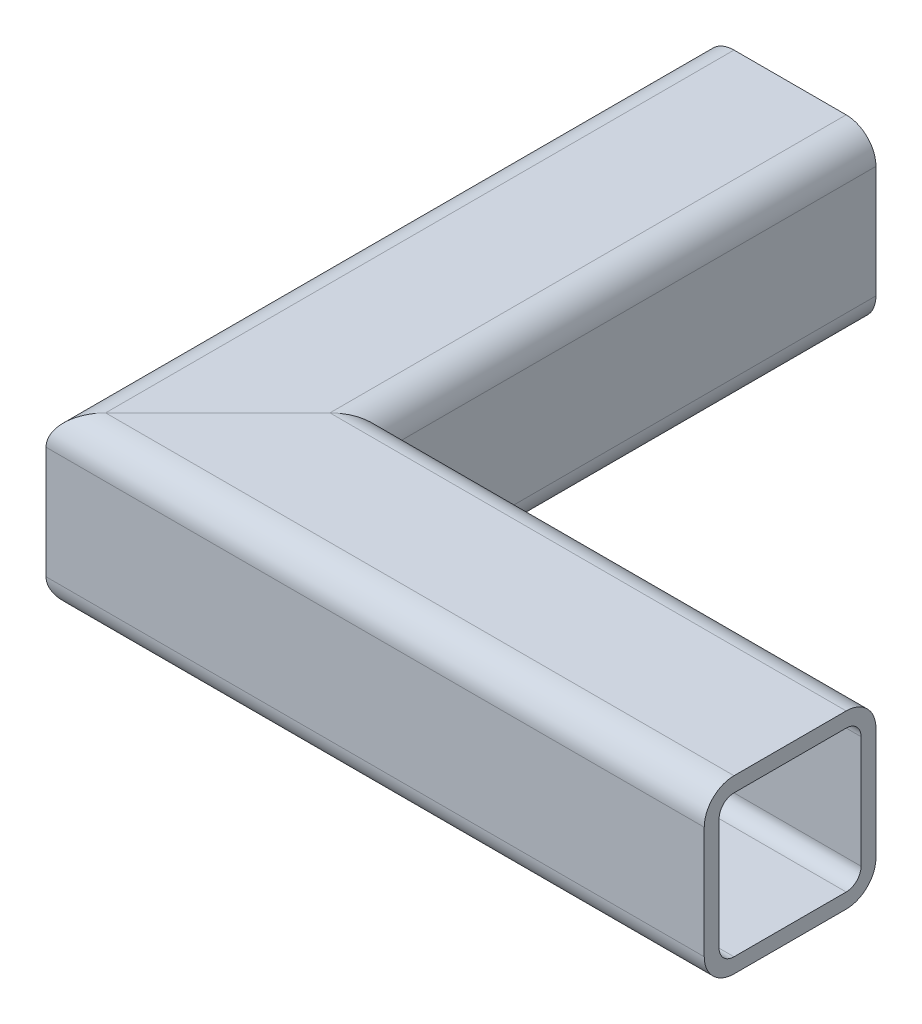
SolidWorks part; units mm, degrees
other "DetailItem2"
other "Weld Folder"
other "Weld Bead2"
ref_plane "Front Plane" through (0, 0, 0) normal (0, 0, 1) x (1, 0, 0)
ref_plane "Top Plane" through (0, 0, 0) normal (0, 1, 0) x (1, 0, 0)
ref_plane "Right Plane" through (0, 0, 0) normal (1, 0, 0) x (0, 0, -1)
sketch "Sketch1" plane through (0, 0, 0) normal (0, 1, 0) x (1, 0, 0)
  line L0 (0, 100) -> (0, 0)
  line L1 (0, 0) -> (100, 0)
  dimension "D1" = 100
other "Square tube 30 X 30 X 2.6(1)"
ref_plane "Plane1" through (0, 0, 0) normal (1, 0, 0) x (0, 0, -1)
sketch "Sketch115" plane through (0, 0, 0) normal (1, 0, 0) x (0, 0, -1)
  line L0 (-9.8, -12.4) -> (9.8, -12.4)
  line L1 (-12.4, -9.8) -> (-12.4, 9.8)
  line L2 (9.8, 12.4) -> (-9.8, 12.4)
  line L3 (12.4, 9.8) -> (12.4, -9.8)
  line L4 (-9.8, -15) -> (9.8, -15)
  line L5 (-15, -9.8) -> (-15, 9.8)
  line L6 (9.8, 15) -> (-9.8, 15)
  line L7 (15, 9.8) -> (15, -9.8)
  arc A0 (15, 9.8) -> (9.8, 15) centre (9.8, 9.8) ccw
  arc A1 (9.8, -15) -> (15, -9.8) centre (9.8, -9.8) ccw
  arc A2 (-15, -9.8) -> (-9.8, -15) centre (-9.8, -9.8) ccw
  arc A3 (-9.8, 15) -> (-15, 9.8) centre (-9.8, 9.8) ccw
  arc A4 (-9.8, 12.4) -> (-12.4, 9.8) centre (-9.8, 9.8) ccw
  arc A5 (12.4, 9.8) -> (9.8, 12.4) centre (9.8, 9.8) ccw
  arc A6 (9.8, -12.4) -> (12.4, -9.8) centre (9.8, -9.8) ccw
  arc A7 (-12.4, -9.8) -> (-9.8, -12.4) centre (-9.8, -9.8) ccw
  point P0 (-15, 0)
  point P1 (15, 0)
  point P2 (0, 15)
  point P3 (0, -15)
  point P4 (0, 0)
  point P5 (-15, -15)
  point P6 (15, -15)
  point P7 (15, 15)
  point P8 (-15, 15)
  point P33 (0, 0)
  dimension "D1" = 5.2
  dimension "Thickness" = 2.6
  dimension "V_leg" = 30
other "Square tube 30 X 30 X 2.6(2)"
ref_plane "Plane2" through (0, 0, -100) normal (0, 0, 1) x (1, 0, 0)
sketch "Sketch117" plane through (0, 0, -100) normal (0, 0, 1) x (1, 0, 0)
  line L0 (-9.8, -12.4) -> (9.8, -12.4)
  line L1 (-12.4, -9.8) -> (-12.4, 9.8)
  line L2 (9.8, 12.4) -> (-9.8, 12.4)
  line L3 (12.4, 9.8) -> (12.4, -9.8)
  line L4 (-9.8, -15) -> (9.8, -15)
  line L5 (-15, -9.8) -> (-15, 9.8)
  line L6 (9.8, 15) -> (-9.8, 15)
  line L7 (15, 9.8) -> (15, -9.8)
  arc A0 (15, 9.8) -> (9.8, 15) centre (9.8, 9.8) ccw
  arc A1 (9.8, -15) -> (15, -9.8) centre (9.8, -9.8) ccw
  arc A2 (-15, -9.8) -> (-9.8, -15) centre (-9.8, -9.8) ccw
  arc A3 (-9.8, 15) -> (-15, 9.8) centre (-9.8, 9.8) ccw
  arc A4 (-9.8, 12.4) -> (-12.4, 9.8) centre (-9.8, 9.8) ccw
  arc A5 (12.4, 9.8) -> (9.8, 12.4) centre (9.8, 9.8) ccw
  arc A6 (9.8, -12.4) -> (12.4, -9.8) centre (9.8, -9.8) ccw
  arc A7 (-12.4, -9.8) -> (-9.8, -12.4) centre (-9.8, -9.8) ccw
  point P0 (-15, 0)
  point P1 (15, 0)
  point P2 (0, 15)
  point P3 (0, -15)
  point P4 (0, 0)
  point P5 (-15, -15)
  point P6 (15, -15)
  point P7 (15, 15)
  point P8 (-15, 15)
  point P33 (0, 0)
  dimension "D1" = 5.2
  dimension "Thickness" = 2.6
  dimension "V_leg" = 30
other "Trim/Extend1"
